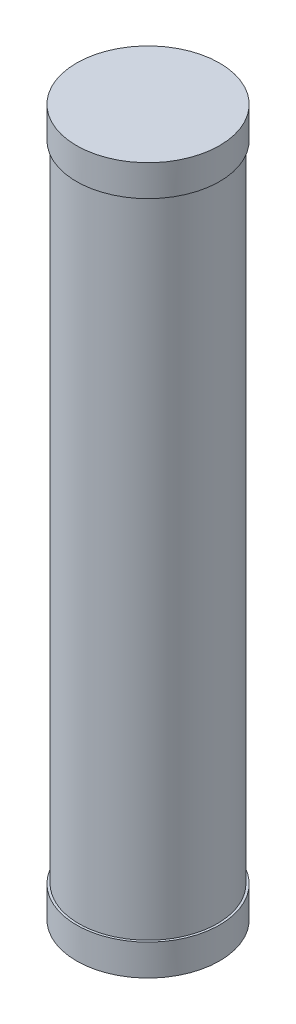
SolidWorks part; units mm, degrees
ref_plane "Alzado" through (0, 0, 0) normal (0, 0, 1) x (1, 0, 0)
ref_plane "Planta" through (0, 0, 0) normal (0, 1, 0) x (1, 0, 0)
ref_plane "Vista lateral" through (0, 0, 0) normal (1, 0, 0) x (0, 0, -1)
sketch "Croquis2" plane through (0, 0, 0) normal (0, 1, 0) x (1, 0, 0)
  circle A0 centre (0, 0) radius 30
  dimension "D1" = 60
extrude "Saliente-Extruir1" add sketch "Croquis2" along normal mid plane 303
sketch "Croquis3" plane through (0, 151.5, 0) normal (0, 1, 0) x (1, 0, 0)
  circle A0 centre (0, 0) radius 31
  dimension "D1" = 62
extrude "Saliente-Extruir2" add sketch "Croquis3" along normal blind 1.5 separate body
sketch "Croquis4" plane through (0, 151.5, 0) normal (0, -1, 0) x (1, 0, 0)
  circle A0 centre (0, 0) radius 31
  circle A1 centre (0, 0) radius 30
  circle A2 centre (0, 0) radius 31 construction
extrude "Saliente-Extruir3" add sketch "Croquis4" along normal blind 12
mirror "Simetría2" about plane through (0, 0, 0) normal (0, 1, 0)
ref_plane "Plano1" through (0, 0, 0) normal (0, 0, 1) x (1, 0, 0)
